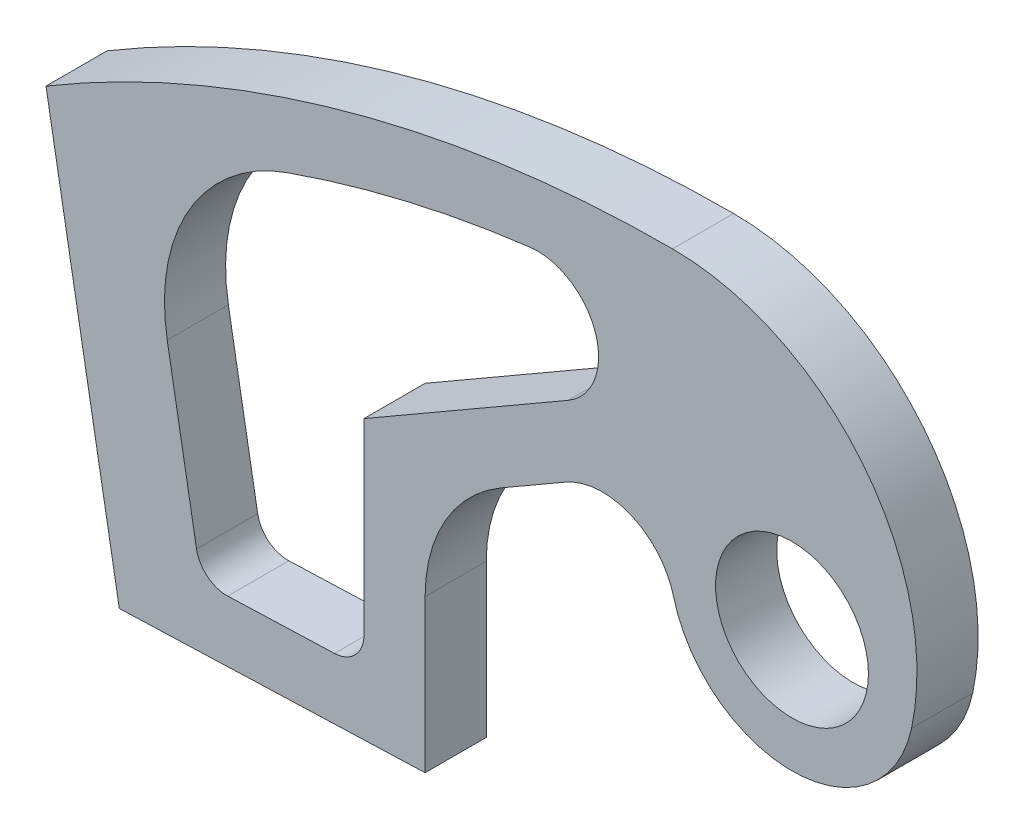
SolidWorks part; units mm, degrees
ref_plane "Plan de face" through (0, 0, 0) normal (0, 0, 1) x (1, 0, 0)
ref_plane "Plan de dessus" through (0, 0, 0) normal (0, 1, 0) x (1, 0, 0)
ref_plane "Plan de droite" through (0, 0, 0) normal (1, 0, 0) x (0, 0, -1)
sketch "Esquisse1" plane through (0, 0, 0) normal (0, 0, 1) x (1, 0, 0)
  line L0 (0, 0) -> (-11.9902, 68)
  line L1 (0, 0) -> (50.0098, 1.7464)
  line L2 (50.0098, 1.7464) -> (50.0098, 26.6975)
  line L3 (62.5098, 48.3482) -> (73.002, 54.4058)
  line L4 (-11.9902, 68) -> (-11.9902, 24.609) construction
  line L5 (0, 0) -> (34.9532, 0) construction
  line L6 (110.0098, 52) -> (21.0906, 52) construction
  line L7 (110.0098, 52) -> (110.0098, 7.743) construction
  line L8 (60.0098, 52) -> (60.0098, -2.8836) construction
  line L9 (90.4714, 96.1806) -> (96.7754, 131.9326) construction
  line L10 (58.8696, 55.1099) -> (82.1387, 68.5443) construction
  line L11 (136.2742, 44) -> (79.0098, 44) construction
  line L12 (17.7284, 10.6252) -> (35.1843, 11.2348)
  line L13 (40.0098, 16.2317) -> (40.0098, 46.9048)
  line L14 (40.0098, 46.9048) -> (73.3816, 66.172)
  line L16 (7.8361, 41.9409) -> (12.6299, 14.7539)
  arc A0 (50.0098, 26.6975) -> (62.5098, 48.3482) centre (75.0098, 26.6975) cw
  arc A1 (73.002, 54.4058) -> (90.6442, 47.0024) centre (79.0098, 44) cw
  arc A2 (90.6442, 47.0024) -> (129.5679, 47.8194) centre (110.0098, 52) ccw
  arc A3 (129.5679, 47.8194) -> (90.4714, 96.1806) centre (90.4516, 56.1806) ccw
  arc A4 (-11.9902, 68) -> (90.4714, 96.1806) centre (90.3724, -103.8194) cw
  arc A5 (73.3816, 66.172) -> (67.1598, 84.7573) centre (68.3816, 74.8323) ccw
  arc A6 (27.4443, 75.4571) -> (7.8361, 41.9409) centre (37.3803, 47.1503) ccw
  arc A7 (17.7284, 10.6252) -> (12.6299, 14.7539) centre (17.5539, 15.6221) cw
  arc A8 (35.1843, 11.2348) -> (40.0098, 16.2317) centre (35.0098, 16.2317) ccw
  arc A9 (27.4443, 75.4571) -> (67.1598, 84.7573) centre (90.3724, -103.8194) cw
  dimension "D4" = 20
  dimension "D5" = 200
  dimension "D6" = 40
  dimension "D7" = 122
  dimension "D3" = 60
  dimension "D13" = 25
  dimension "D15" = 5
  dimension "D16" = 30
  dimension "D17" = 10
  dimension "D21" = 190
  dimension "D1" = 2
  dimension "D2" = 10
  dimension "D8" = 52
  dimension "D9" = 50
  dimension "D10" = 10
  dimension "D11" = 8
  dimension "D12" = 31
  dimension "D14" = 30
  dimension "D18" = 10
  dimension "D19" = 10
  dimension "D20" = 10
  dimension "D22" = 15
extrude "Boss.-Extru.1" add sketch "Esquisse1" along normal blind 10
sketch "Esquisse2" plane through (0, 0, 10) normal (0, 0, 1) x (1, 0, 0)
  circle A0 centre (110.0098, 52) radius 12.5
  dimension "D1" = 25
extrude "Enlèv. mat.-Extru.1" cut sketch "Esquisse2" against normal blind 10
